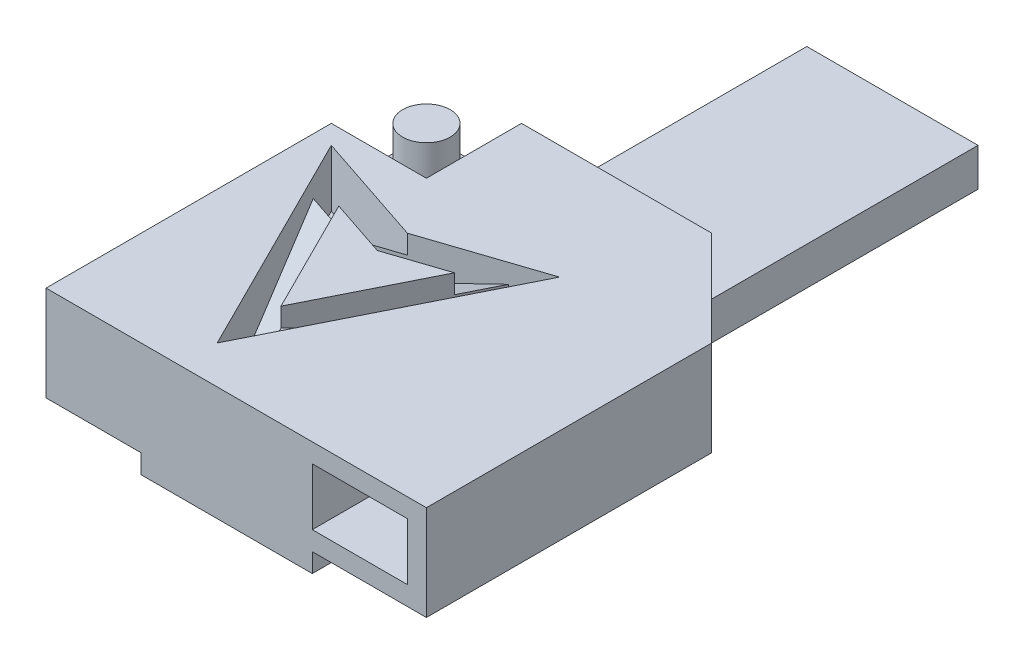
SolidWorks part; units mm, degrees
ref_plane "Alzado" through (0, 0, 0) normal (0, 0, 1) x (1, 0, 0)
ref_plane "Planta" through (0, 0, 0) normal (0, 1, 0) x (1, 0, 0)
ref_plane "Vista lateral" through (0, 0, 0) normal (1, 0, 0) x (0, 0, -1)
sketch "Croquis1" plane through (0, 0, 0) normal (0, 1, 0) x (1, 0, 0)
  line L0 (5, 10) -> (10, 5)
  line L1 (-10, -10) -> (10, -10)
  line L2 (-10, -10) -> (-10, 10)
  line L3 (-10, 10) -> (5, 10)
  line L4 (10, -10) -> (10, 5)
  line L5 (-10, -10) -> (10, 10) construction
  line L6 (-10, 10) -> (10, -10) construction
  line L7 (5, 10) -> (10, 10) construction
  line L8 (10, 10) -> (10, 5) construction
  line L9 (0, 0) -> (0, 20) construction
  point P0 (0, 0)
  point P10 (0, 16.7722)
  dimension "D1" = 10
  dimension "20" = 20
  dimension "D2" = 20
  dimension "D3" = 15
  dimension "D4" = 15
extrude "Saliente-Extruir1" add sketch "Croquis1" along normal blind 5
sketch "Croquis2" plane through (0, 5, 0) normal (0, 1, 0) x (1, 0, 0)
  line L0 (-6.0389, 1.4318) -> (-8.0513, 2.1026) construction
  line L1 (-6.0389, 1.4318) -> (-3, 0.4189)
  line L2 (-10, -10) -> (10, -10) construction
  line L10 (3, 4) -> (-3, -8)
  line L11 (-3, -8) -> (-9, 4)
  line L14 (-9, 4) -> (-3, 2)
  line L15 (-3, 2) -> (3, 4)
  line L16 (0.0389, 1.4318) -> (-3, -4.6459)
  line L17 (-3, -4.6459) -> (-6.0389, 1.4318)
  line L23 (-3, 0.4189) -> (0.0389, 1.4318)
  line L24 (-7.5, 10) -> (-7.5, 5) construction
  line L25 (-10, 10) -> (-5, 10)
  line L26 (-10, 10) -> (-10, 5)
  line L27 (-10, 5) -> (-5, 5)
  line L28 (-5, 10) -> (-5, 5)
  line L29 (-10, 7.5) -> (-5, 7.5) construction
  line L30 (-10, 10) -> (-10, -10) construction
  line L31 (-3, -4.6459) -> (-2.1615, -6.3229) construction
  line L32 (-3, 2) -> (-5.3717, 1.2094) construction
  line L33 (0.0389, 1.4318) -> (0.9875, 3.3292) construction
  circle A0 centre (-7.5, 7.5) radius 1.25
  circle A1 centre (-7.5194, 2.7159) radius 0.75 construction
  point P24 (-7.5, 7.5)
  dimension "D1" = 1.5
  dimension "D2" = 2
  dimension "D4" = 2.5
  dimension "D3" = 5
  dimension "D5" = 1.5
  dimension "D6" = 1.5
  dimension "D7" = 1.5
  dimension "D8" = 12
  dimension "D9" = 12
  dimension "D10" = 7
  dimension "D11" = 2
extrude "Cortar-Extruir4" cut sketch "Croquis2" against normal blind 3
sketch "Croquis15" plane through (-4.2584, 0, 2.1292) normal (-0.8944, 0, 0.4472) x (0.4472, 0, 0.8944)
  line L0 (2.8138, 2) -> (4.6888, 2) construction
  line L1 (4.6888, 5) -> (4.6888, 2) construction
  line L2 (4.6888, 2) -> (-3.9813, 2)
  line L3 (-3.9813, 2) -> (-3.9813, 4)
  line L4 (-3.9813, 4) -> (4.6888, 2)
  dimension "D1" = 2
extrude "Saliente-Extruir9" add sketch "Croquis15" along direction (-0.9487, 0, -0.3162) on the side of the normal up to next (1.5 mm away)
sketch "Croquis16" plane through (-0.1743, 0, 0.523) normal (0.3162, 0, -0.9487) x (-0.9487, 0, -0.3162)
  line L1 (5.4785, 5) -> (5.4785, 2) construction
  line L2 (2.9785, 2) -> (8.3031, 2) construction
  line L3 (5.4785, 2) -> (8.3031, 2)
  line L4 (8.3031, 2) -> (5.4785, 4)
  line L5 (5.4785, 4) -> (5.4785, 2)
  dimension "D1" = 2
extrude "Saliente-Extruir10" add sketch "Croquis16" along direction (-0.9487, 0, 0.3162) on the side of the normal up to next (1.5 mm away)
sketch "Croquis17" plane through (-0.9, 0, -2.7) normal (0.3162, 0, 0.9487) x (0.9487, 0, -0.3162)
  line L0 (1.9896, 5) -> (1.9896, 2) construction
  line L1 (4.111, 2) -> (-4.7136, 2) construction
  line L2 (-4.7136, 2) -> (1.9896, 4)
  line L3 (1.9896, 4) -> (1.9896, 2)
  line L4 (1.9896, 2) -> (-4.7136, 2)
  dimension "D1" = 2
extrude "Saliente-Extruir11" add sketch "Croquis17" along direction (0.4472, 0, -0.8944) on the side of the normal up to next (1.5 mm away)
sketch "Croquis18" plane through (-0.5416, 0, -0.2708) normal (0.8944, 0, 0.4472) x (0.4472, 0, -0.8944)
  line L0 (-5.4971, 2) -> (-5.4971, 5) construction
  line L1 (-5.4971, 2.4325) -> (-5.4971, 5) construction
  line L2 (-5.4971, 4) -> (-5.4971, 2)
  line L3 (-5.4971, 2) -> (3.4193, 2)
  line L4 (3.4193, 2) -> (-5.4971, 4)
  dimension "D1" = 2
extrude "Saliente-Extruir12" add sketch "Croquis18" along direction (0.4472, 0, 0.8944) on the side of the normal up to next (1.5 mm away)
sketch "Croquis19" plane through (0, 0, 10) normal (0, 0, 1) x (1, 0, 0)
  line L1 (9, 1) -> (4, 1)
  line L2 (9, 1) -> (9, 4)
  line L3 (9, 4) -> (4, 4)
  line L4 (4, 1) -> (4, 4)
  line L5 (10, 5) -> (10, 0) construction
  line L6 (-10, 0) -> (10, 0) construction
  dimension "D1" = 3
  dimension "D2" = 1
  dimension "D3" = 5
  dimension "D4" = 1
extrude "Cortar-Extruir5" cut sketch "Croquis19" against normal through all
sketch "Croquis21" plane through (0, 0, -10) normal (0, 0, -1) x (-1, 0, 0)
  line L1 (-4, 1) -> (5, 1)
  line L2 (-4, 1) -> (-4, -1)
  line L3 (-4, -1) -> (5, -1)
  line L4 (5, 1) -> (5, -1)
  line L8 (5, 2) -> (5, 5) construction
  line L10 (-4, 4) -> (-4, 1) construction
  line L11 (-5, 0) -> (10, 0) construction
  dimension "D1" = 2
  dimension "D2" = 1
extrude "Saliente-Extruir13" add sketch "Croquis21" along normal blind 15 and the other way blind 20
